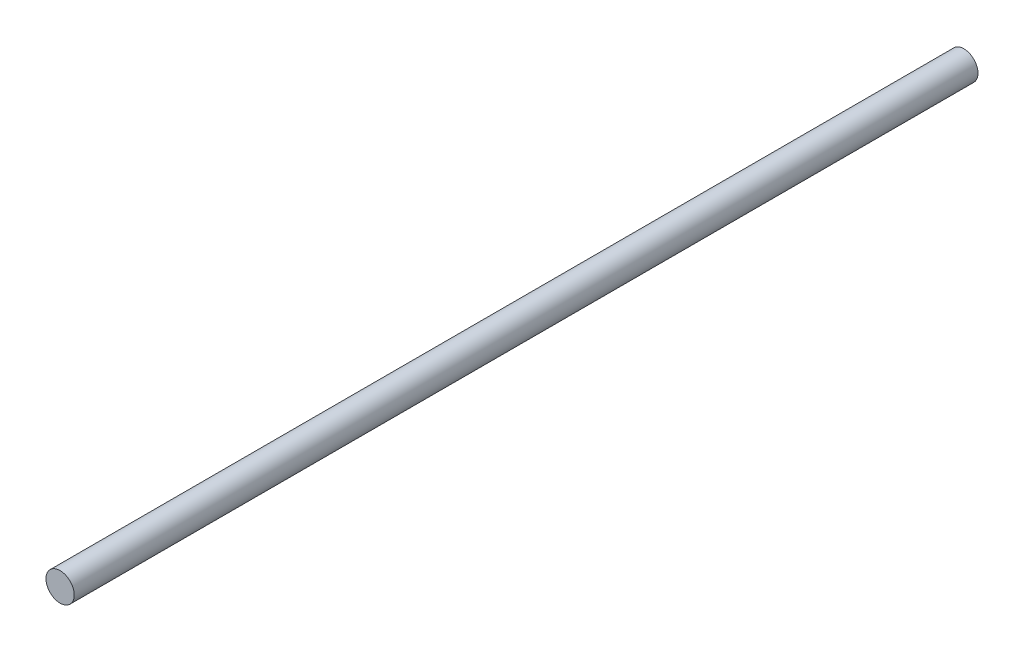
SolidWorks part; units mm, degrees
ref_plane "Face" through (0, 0, 0) normal (0, 0, 1) x (1, 0, 0)
ref_plane "Dessus" through (0, 0, 0) normal (0, 1, 0) x (1, 0, 0)
ref_plane "Droite" through (0, 0, 0) normal (1, 0, 0) x (0, 0, -1)
sketch "Esquisse1" plane through (0, 0, 0) normal (0, 0, 1) x (1, 0, 0)
  circle A1 centre (24, 27) radius 1.25
  dimension "D1" = 2.5
extrude "Base-Extrusion" add sketch "Esquisse1" along normal blind 80
